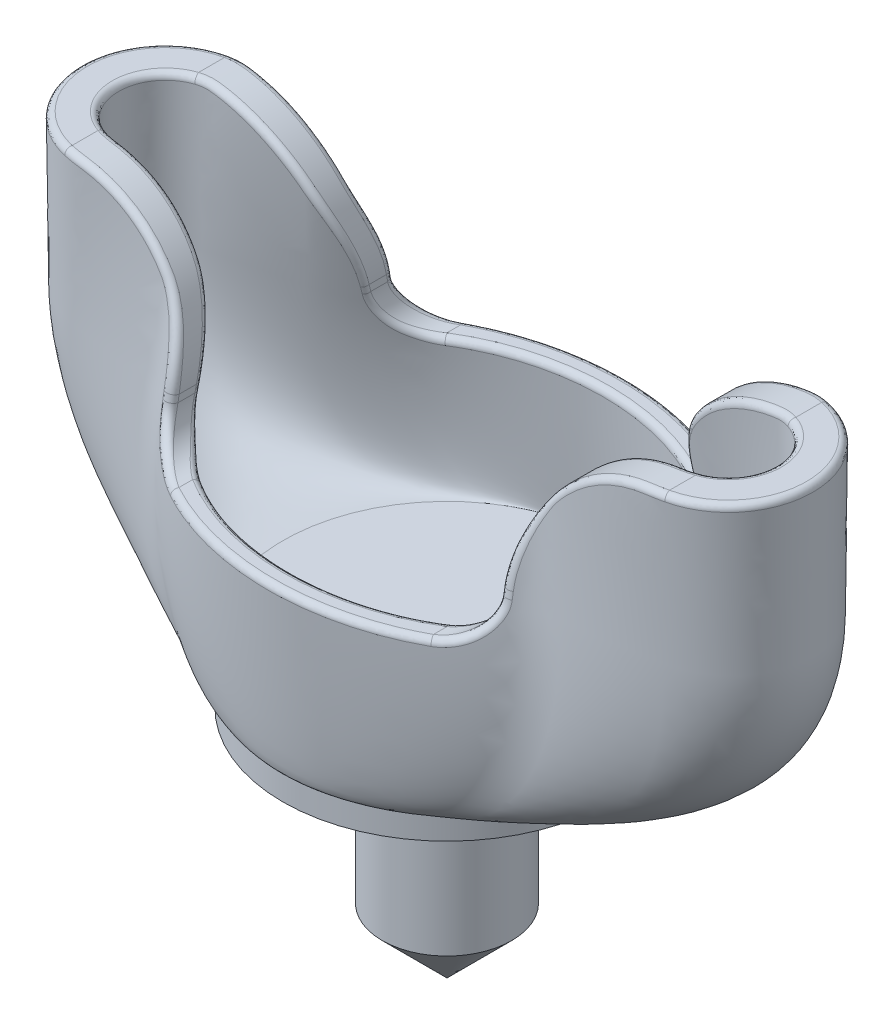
SolidWorks part; units mm, degrees
ref_plane "Front Plane" through (0, 0, 0) normal (0, 0, 1) x (1, 0, 0)
ref_plane "Top Plane" through (0, 0, 0) normal (0, 1, 0) x (1, 0, 0)
ref_plane "Right Plane" through (0, 0, 0) normal (1, 0, 0) x (0, 0, -1)
other "Configuration Table"
sketch "Sketch1" plane through (0, 0, 0) normal (0, 0, 1) x (1, 0, 0)
  line L0 (0, 10.7344) -> (0, -7.5424) construction
  line L1 (4.445, 5.334) -> (4.445, 6.5193)
  line L2 (-4.445, 0) -> (4.445, 0)
  line L3 (9.906, 10.16) -> (8.0857, 10.16)
  line L4 (-4.445, 5.334) -> (4.445, 5.334)
  line L5 (9.906, 10.16) -> (8.3762, 10.16) construction
  line L6 (9.906, 10.16) -> (9.906, 5.7504) construction
  line L7 (9.906, 10.16) -> (9.906, 6.1278)
  line L8 (4.445, 0) -> (4.445, 0.6667)
  line L9 (4.445, 0.6667) -> (0.3077, 0.6667) construction
  line L10 (-4.445, 0) -> (-4.445, 0.6667)
  line L11 (-9.906, 10.16) -> (-9.906, 6.1277)
  line L12 (-9.906, 10.16) -> (-8.0857, 10.16)
  line L13 (-4.445, 5.334) -> (-4.445, 6.5193)
  arc A5 (8.0857, 10.16) -> (4.445, 6.5193) centre (8.0857, 6.5193) ccw
  arc A6 (4.445, 0.6667) -> (9.906, 6.1278) centre (4.445, 6.1277) ccw
  arc A7 (-8.0857, 10.16) -> (-4.445, 6.5193) centre (-8.0857, 6.5193) cw
  arc A8 (-4.445, 0.6667) -> (-9.906, 6.1277) centre (-4.445, 6.1277) cw
  point P4 (0, 5.334)
  point P19 (0, 0)
ref_plane "Plane4" through (0, 10.16, 0) normal (0, 1, 0) x (-1, 0, 0)
ref_plane "Plane5" through (0, 0.6667, 0) normal (0, 1, 0) x (-1, 0, 0)
sketch "Sketch2" plane through (0, 10.16, 0) normal (0, 1, 0) x (-1, 0, 0)
  line L0 (4.445, 0) -> (-4.445, 0) construction
  line L1 (5.1243, -2.286) -> (7.62, -2.286)
  line L2 (0, 0) -> (14.2067, 0) construction
  line L3 (5.1243, 2.286) -> (7.62, 2.286)
  line L4 (0, 0) -> (0, 10.869) construction
  line L5 (0, 0) -> (0, -9.6836) construction
  line L6 (-5.1243, 2.286) -> (-7.62, 2.286)
  line L7 (-5.1243, -2.286) -> (-7.62, -2.286)
  arc A0 (4.2702, 2.7517) -> (-4.2702, 2.7517) centre (0, 0) ccw
  arc A1 (7.62, 2.286) -> (7.62, -2.286) centre (7.62, 0) cw
  arc A2 (-4.2702, -2.7517) -> (4.2702, -2.7517) centre (0, 0) ccw
  arc A3 (-7.62, 2.286) -> (-7.62, -2.286) centre (-7.62, 0) ccw
  arc A4 (-5.1243, 2.286) -> (-4.2702, 2.7517) centre (-5.1243, 3.302) ccw
  arc A5 (-5.1243, -2.286) -> (-4.2702, -2.7517) centre (-5.1243, -3.302) cw
  arc A6 (5.1243, 2.286) -> (4.2702, 2.7517) centre (5.1243, 3.302) cw
  arc A7 (5.1243, -2.286) -> (4.2702, -2.7517) centre (5.1243, -3.302) ccw
  point P20 (-4.5366, 2.286)
  point P23 (-4.5366, -2.286)
  point P26 (4.5366, 2.286)
  point P29 (4.5366, -2.286)
  dimension "F" = 10.16
  dimension "C" = 4.572
sketch "Sketch9" plane through (0, 0, 0) normal (0, 0, 1) x (1, 0, 0)
  line L0 (-9.906, 10.16) -> (-9.906, 6.1277) construction
  line L1 (-9.906, 10.16) -> (-9.906, 6.1277)
  arc A0 (-9.906, 6.1277) -> (-4.445, 0.6667) centre (-4.445, 6.1277) ccw construction
  arc A2 (-9.906, 6.1277) -> (-4.445, 0.6667) centre (-4.445, 6.1277) ccw
sketch "Sketch10" plane through (0, 0, 0) normal (0, 0, 1) x (1, 0, 0)
  line L0 (9.906, 10.16) -> (9.906, 6.1277) construction
  line L1 (9.906, 10.16) -> (9.906, 6.1277)
  arc A1 (4.445, 0.6668) -> (9.906, 6.1277) centre (4.445, 6.1277) ccw construction
  arc A2 (4.445, 0.6668) -> (9.906, 6.1277) centre (4.445, 6.1277) ccw
sketch "Sketch18" plane through (0, 0.6667, 0) normal (0, 1, 0) x (-1, 0, 0)
  circle A0 centre (0, 0) radius 4.445
loft "Loft2" add profiles "Sketch18", "Sketch2"
ref_plane "Plane6" through (0, 1.6827, 0) normal (0, 1, 0) x (-1, 0, 0)
sketch "Sketch20" plane through (0, 1.6827, 0) normal (0, 1, 0) x (-1, 0, 0)
  circle A0 centre (0, 0) radius 4.445 construction
  circle A1 centre (0, 0) radius 4.445
sketch "Sketch21" plane through (0, 10.16, 0) normal (0, 1, 0) x (-1, 0, 0)
  line L8 (-5.1243, 1.27) -> (-7.62, 1.27)
  line L9 (-7.62, -1.27) -> (-5.1243, -1.27)
  line L10 (5.1243, -1.27) -> (7.62, -1.27)
  line L11 (7.62, 1.27) -> (5.1243, 1.27)
  line L12 (-5.1243, 1.27) -> (-7.62, 1.27)
  line L13 (-7.62, -1.27) -> (-5.1243, -1.27)
  line L14 (5.1243, -1.27) -> (7.62, -1.27)
  line L15 (7.62, 1.27) -> (5.1243, 1.27)
  arc A16 (-7.62, 1.27) -> (-7.62, -1.27) centre (-7.62, 0) ccw
  arc A17 (-3.4162, -2.2013) -> (-5.1243, -1.27) centre (-5.1243, -3.302) ccw
  arc A18 (-3.4162, -2.2013) -> (3.4162, -2.2013) centre (0, 0) ccw
  arc A19 (5.1243, -1.27) -> (3.4162, -2.2013) centre (5.1243, -3.302) ccw
  arc A20 (7.62, -1.27) -> (7.62, 1.27) centre (7.62, 0) ccw
  arc A21 (3.4162, 2.2013) -> (5.1243, 1.27) centre (5.1243, 3.302) ccw
  arc A22 (3.4162, 2.2013) -> (-3.4162, 2.2013) centre (0, 0) ccw
  arc A23 (-5.1243, 1.27) -> (-3.4162, 2.2013) centre (-5.1243, 3.302) ccw
  arc A24 (-7.62, 1.27) -> (-7.62, -1.27) centre (-7.62, 0) ccw
  arc A25 (-3.4162, -2.2013) -> (-5.1243, -1.27) centre (-5.1243, -3.302) ccw
  arc A26 (-3.4162, -2.2013) -> (3.4162, -2.2013) centre (0, 0) ccw
  arc A27 (5.1243, -1.27) -> (3.4162, -2.2013) centre (5.1243, -3.302) ccw
  arc A28 (7.62, -1.27) -> (7.62, 1.27) centre (7.62, 0) ccw
  arc A29 (3.4162, 2.2013) -> (5.1243, 1.27) centre (5.1243, 3.302) ccw
  arc A30 (3.4162, 2.2013) -> (-3.4162, 2.2013) centre (0, 0) ccw
  arc A31 (-5.1243, 1.27) -> (-3.4162, 2.2013) centre (-5.1243, 3.302) ccw
sketch "Sketch22" plane through (0, 0, 0) normal (0, 0, 1) x (1, 0, 0)
  line L2 (-8.89, 10.16) -> (-8.89, 6.1277)
  line L3 (-8.89, 10.16) -> (-8.89, 6.1277)
  arc A2 (-8.89, 6.1277) -> (-4.445, 1.6827) centre (-4.445, 6.1277) ccw
  arc A3 (-8.89, 6.1277) -> (-4.445, 1.6827) centre (-4.445, 6.1277) ccw
sketch "Sketch23" plane through (0, 0, 0) normal (0, 0, 1) x (1, 0, 0)
  line L2 (8.89, 10.16) -> (8.89, 6.1277)
  line L3 (8.89, 10.16) -> (8.89, 6.1277)
  arc A2 (4.445, 1.6828) -> (8.89, 6.1277) centre (4.445, 6.1277) ccw
  arc A3 (4.445, 1.6828) -> (8.89, 6.1277) centre (4.445, 6.1277) ccw
loft "Cut-Loft1" cut profiles "Sketch20", "Sketch21"
sketch "Sketch14" plane through (0, 0, 0) normal (0, 0, 1) x (1, 0, 0)
  line L0 (0, 0) -> (0, -9.7552) construction
  line L2 (0, 0) -> (0, -6.35)
  line L3 (0, -6.35) -> (1.7526, -6.35)
  line L4 (1.7526, 0) -> (1.7526, -6.35)
  line L5 (1.7526, 0) -> (4.445, 0)
  line L6 (4.445, 0) -> (4.445, 0.6667)
  line L7 (4.445, 0.6667) -> (0, 0.6667)
  line L8 (0, 10.7344) -> (0, -7.5424) construction
  line L9 (6.9245, 0.6667) -> (-6.9245, 0.6667) construction
  line L10 (0, 0.6667) -> (0, 0)
revolve "Revolve1" add sketch "Sketch14" angle 360 about L0
sketch "Sketch16" plane through (0, 0, 0) normal (0, 0, 1) x (1, 0, 0)
  line L0 (-9.906, 10.16) -> (-9.906, 11.16)
  line L1 (-9.906, 11.16) -> (9.906, 11.16)
  line L2 (9.906, 11.16) -> (9.906, 10.16)
  line L10 (-4.445, 0) -> (4.445, 0)
  line L11 (4.445, 0) -> (4.445, 0.6667)
  line L12 (9.906, 6.1277) -> (9.906, 10.16)
  line L13 (9.906, 10.16) -> (8.0857, 10.16)
  line L14 (4.445, 6.5193) -> (4.445, 5.334)
  line L15 (4.445, 5.334) -> (-4.445, 5.334)
  line L16 (-4.445, 5.334) -> (-4.445, 6.5193)
  line L17 (-8.0857, 10.16) -> (-9.906, 10.16)
  line L18 (-9.906, 10.16) -> (-9.906, 6.1277)
  line L19 (-4.445, 0.6667) -> (-4.445, 0)
  line L23 (9.906, 10.16) -> (8.0857, 10.16)
  line L24 (4.445, 6.5193) -> (4.445, 5.334)
  line L25 (4.445, 5.334) -> (-4.445, 5.334)
  line L26 (-4.445, 5.334) -> (-4.445, 6.5193)
  line L27 (-8.0857, 10.16) -> (-9.906, 10.16)
  arc A4 (4.445, 0.6667) -> (9.906, 6.1277) centre (4.445, 6.1277) ccw
  arc A5 (8.0857, 10.16) -> (4.445, 6.5193) centre (8.0857, 6.5193) ccw
  arc A6 (-4.445, 6.5193) -> (-8.0857, 10.16) centre (-8.0857, 6.5193) ccw
  arc A7 (-9.906, 6.1277) -> (-4.445, 0.6667) centre (-4.445, 6.1277) ccw
  arc A9 (8.0857, 10.16) -> (4.445, 6.5193) centre (8.0857, 6.5193) ccw
  arc A10 (-4.445, 6.5193) -> (-8.0857, 10.16) centre (-8.0857, 6.5193) ccw
  dimension "D2" = 1
  dimension "D1" = 0
extrude "Cut-Extrude1" cut sketch "Sketch16" against normal through all and the other way through all
fillet "Fillet1" radius 1 4 edges at (4.445, 5.334, -2.924) (4.445, 5.334, 2.924) (-4.445, 5.334, -2.924) (-4.445, 5.334, 2.924)
fillet "Fillet2" radius 0.1693 32 edges at (-5.4656, 9.0471, -1.4153) (-5.968, 9.4808, 1.3386) (-4.1482, 5.623, -2.6418) (0.7192, 5.334, -4.1865) (4.2763, 5.7781, -2.5192) (5.4656, 9.0471, 1.4153) (5.968, 9.4808, -1.3386) (4.1482, 5.623, 2.6418) (-0.7192, 5.334, 4.1865) (-4.2763, 5.7781, 2.5192) (-5.3715, 8.9458, 2.3716) (-5.3444, 8.9152, -2.375) (-4.2761, 5.7779, -3.4455) (1.9112, 5.334, -4.5997) (4.1338, 5.609, -3.5649) (5.3444, 8.9152, 2.375) (5.3715, 8.9458, -2.3716) (4.2761, 5.7779, 3.4455) (-1.9112, 5.334, 4.5997) (-4.1338, 5.609, 3.5649)
sketch "Sketch27" plane through (0, 0, 0) normal (0, 0, 1) x (1, 0, 0)
  line L0 (0, 0) -> (0, -9.1725) construction
  line L1 (-4.445, 0) -> (4.445, 0) construction
  line L2 (0, -6.35) -> (1.7701, -4.5799)
  line L4 (1.7701, -4.5799) -> (1.7701, -6.3754)
  line L6 (-1.7526, -6.35) -> (1.7526, -6.35) construction
  line L7 (0, -6.35) -> (0, -6.3754)
  line L8 (0, -6.3754) -> (1.7701, -6.3754)
revolve "Cut-Revolve11" cut sketch "Sketch27" angle 360 about L0
sketch "Sketch26" plane through (0, 0, 0) normal (0, 0, 1) x (1, 0, 0)
  line L0 (0, 0) -> (0, -6.8807) construction
  line L1 (-1.7526, 0) -> (1.7526, 0) construction
  line L2 (1.2802, -0.2753) -> (1.7526, -0.0025)
  line L3 (1.7526, -0.0025) -> (1.7526, -0.5481)
  line L4 (1.7526, -0.5481) -> (1.2802, -0.2753)
  line L9 (1.2802, -0.2753) -> (1.2802, -1.0678) construction
revolve "Cut-Revolve10" [suppressed] cut sketch "Sketch26" angle 360 about L0
pattern_linear "LPattern10" [suppressed] count 8 along (0, -1, 0)
equation "\"D1@Sketch1\" = (  \"A@Sketch1\" - \"EE@Sketch1\"  ) / 2 / 3"
equation "\"D2@Sketch1\" = \"G@Sketch1\" / 8"
equation "\"D1@LPattern10\" =\"L@Sketch14\" / \"pitch@Sketch26\" "
equation "\"EE@Sketch1\" = \"E@Sketch1\""
equation "\"LL@Cosmetic Thread1\" = \"L@Sketch14\""
equation "\"D1@Fillet2\" = \"T\" / 6"
equation "\"D1@Sketch26\" = \"d1@Sketch14\""
equation "\"D2@Sketch26\" = \"THD_MINOR@Cosmetic Thread1\""
equation "\"PITCH@LPattern10\" = \"pitch@Sketch26\""
equation "\"D2@Sketch27\" = \"d1@Sketch14\" * 1.01"
